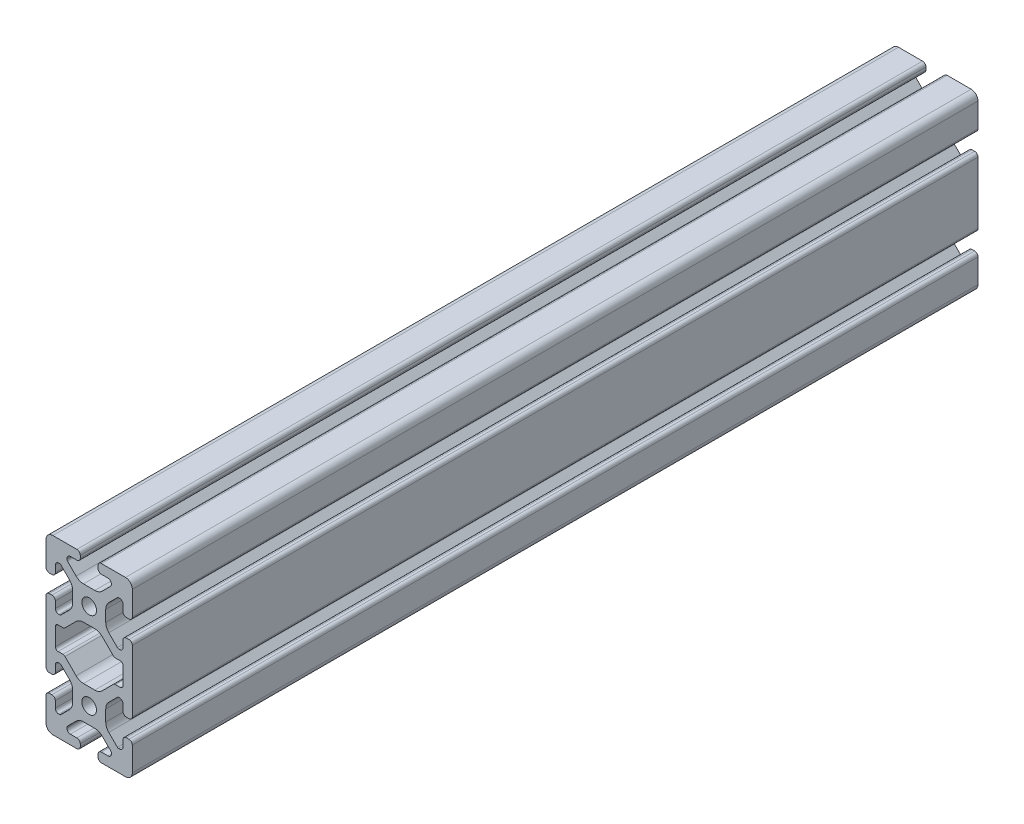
SolidWorks part; units mm, degrees
ref_plane "Front Plane" through (0, 0, 0) normal (0, 0, 1) x (1, 0, 0)
ref_plane "Top Plane" through (0, 0, 0) normal (0, 1, 0) x (1, 0, 0)
ref_plane "Right Plane" through (0, 0, 0) normal (1, 0, 0) x (0, 0, -1)
ref_plane "Plane1" through (0, 0, -3048) normal (0, 0, -1) x (-1, 0, 0)
sketch "Sketch1" plane through (0, 0, -3048) normal (0, 0, -1) x (-1, 0, 0)
  line L0 (14.41, 14.6586) -> (12.13, 14.6586)
  line L1 (11.1794, 14.2308) -> (6.0551, 9.1098)
  line L2 (2.6153, 7.685) -> (-2.6153, 7.685)
  line L3 (-6.0551, 9.1098) -> (-11.232, 14.2867)
  line L4 (-12.13, 14.6586) -> (-14.41, 14.6586)
  line L5 (-15.68, 15.9286) -> (-15.68, 24.0714)
  line L6 (-14.41, 25.3414) -> (-12.13, 25.3414)
  line L7 (-11.232, 25.7133) -> (-6.0551, 30.8902)
  line L8 (-2.6153, 32.315) -> (2.6176, 32.315)
  line L9 (6.0573, 30.8902) -> (11.1842, 25.7634)
  line L10 (12.13, 25.3414) -> (14.41, 25.3414)
  line L11 (15.68, 24.0714) -> (15.68, 15.9286)
  line L12 (16.83, 60) -> (5.6904, 60)
  line L13 (4.1204, 58.43) -> (4.1204, 57.25)
  line L14 (5.6904, 55.68) -> (8.7154, 55.68)
  line L15 (10.2854, 54.11) -> (10.2854, 53.6549)
  line L16 (10.0628, 53.1175) -> (6.0551, 49.1098)
  line L17 (2.6153, 47.685) -> (-2.6153, 47.685)
  line L18 (-6.0551, 49.1098) -> (-10.0628, 53.1175)
  line L19 (-10.2854, 53.6549) -> (-10.2854, 54.11)
  line L20 (-8.7154, 55.68) -> (-5.6904, 55.68)
  line L21 (-4.1204, 57.25) -> (-4.1204, 58.43)
  line L22 (-5.6904, 60) -> (-16.83, 60)
  line L23 (-20, 56.83) -> (-20, 45.6904)
  line L24 (-18.43, 44.1204) -> (-17.25, 44.1204)
  line L25 (-15.68, 45.6904) -> (-15.68, 48.7154)
  line L26 (-14.11, 50.2854) -> (-13.6527, 50.2854)
  line L27 (-13.1153, 50.0628) -> (-9.1098, 46.0573)
  line L28 (-7.685, 42.6176) -> (-7.685, 37.3847)
  line L29 (-9.1098, 33.9449) -> (-13.1175, 29.9372)
  line L30 (-13.6549, 29.7146) -> (-14.11, 29.7146)
  line L31 (-15.68, 31.2846) -> (-15.68, 34.3096)
  line L32 (-17.25, 35.8796) -> (-18.43, 35.8796)
  line L33 (-20, 34.3096) -> (-20, 5.6904)
  line L34 (-18.43, 4.1204) -> (-17.25, 4.1204)
  line L35 (-15.68, 5.6904) -> (-15.68, 8.7154)
  line L36 (-14.11, 10.2854) -> (-13.6549, 10.2854)
  line L37 (-13.1175, 10.0628) -> (-9.1098, 6.0551)
  line L38 (-7.685, 2.6153) -> (-7.685, -2.6153)
  line L39 (-9.1098, -6.0551) -> (-13.1175, -10.0628)
  line L40 (-13.6549, -10.2854) -> (-14.11, -10.2854)
  line L41 (-15.68, -8.7154) -> (-15.68, -5.6904)
  line L42 (-17.25, -4.1204) -> (-18.43, -4.1204)
  line L43 (-20, -5.6904) -> (-20, -16.83)
  line L44 (-16.83, -20) -> (-5.6904, -20)
  line L45 (-4.1204, -18.43) -> (-4.1204, -17.25)
  line L46 (-5.6904, -15.68) -> (-8.7154, -15.68)
  line L47 (-10.2854, -14.11) -> (-10.2854, -13.6549)
  line L48 (-10.0628, -13.1175) -> (-6.0551, -9.1098)
  line L49 (-2.6153, -7.685) -> (2.6153, -7.685)
  line L50 (6.0551, -9.1098) -> (10.0628, -13.1175)
  line L51 (10.2854, -13.6549) -> (10.2854, -14.11)
  line L52 (8.7154, -15.68) -> (5.6904, -15.68)
  line L53 (4.1204, -17.25) -> (4.1204, -18.43)
  line L54 (5.6904, -20) -> (16.83, -20)
  line L55 (20, -16.83) -> (20, -5.6904)
  line L56 (18.43, -4.1204) -> (17.25, -4.1204)
  line L57 (15.68, -5.6904) -> (15.68, -8.7154)
  line L58 (14.11, -10.2854) -> (13.6549, -10.2854)
  line L59 (13.1175, -10.0628) -> (9.1098, -6.0551)
  line L60 (7.685, -2.6153) -> (7.685, 2.6153)
  line L61 (9.1098, 6.0551) -> (13.1175, 10.0628)
  line L62 (13.6549, 10.2854) -> (14.11, 10.2854)
  line L63 (15.68, 8.7154) -> (15.68, 5.6904)
  line L64 (17.25, 4.1204) -> (18.43, 4.1204)
  line L65 (20, 5.6904) -> (20, 34.3096)
  line L66 (18.43, 35.8796) -> (17.25, 35.8796)
  line L67 (15.68, 34.3096) -> (15.68, 31.2846)
  line L68 (14.11, 29.7146) -> (13.6549, 29.7146)
  line L69 (13.1175, 29.9372) -> (9.1098, 33.9449)
  line L70 (7.685, 37.3847) -> (7.685, 42.6153)
  line L71 (9.1098, 46.0551) -> (13.1175, 50.0628)
  line L72 (13.6549, 50.2854) -> (14.11, 50.2854)
  line L73 (15.68, 48.7154) -> (15.68, 45.6904)
  line L74 (17.25, 44.1204) -> (18.43, 44.1204)
  line L75 (20, 45.6904) -> (20, 56.83)
  arc A0 (15.68, 15.9286) -> (14.41, 14.6586) centre (14.41, 15.9286) cw
  arc A1 (12.13, 14.6586) -> (11.1794, 14.2308) centre (12.13, 13.3886) ccw
  arc A2 (6.0551, 9.1098) -> (2.6153, 7.685) centre (2.6153, 12.5496) cw
  arc A3 (-2.6153, 7.685) -> (-6.0551, 9.1098) centre (-2.6153, 12.5496) cw
  arc A4 (-11.232, 14.2867) -> (-12.13, 14.6586) centre (-12.13, 13.3886) ccw
  arc A5 (-14.41, 14.6586) -> (-15.68, 15.9286) centre (-14.41, 15.9286) cw
  arc A6 (-15.68, 24.0714) -> (-14.41, 25.3414) centre (-14.41, 24.0714) cw
  arc A7 (-12.13, 25.3414) -> (-11.232, 25.7133) centre (-12.13, 26.6114) ccw
  arc A8 (-6.0551, 30.8902) -> (-2.6153, 32.315) centre (-2.6153, 27.4504) cw
  arc A9 (2.6176, 32.315) -> (6.0573, 30.8902) centre (2.6176, 27.4504) cw
  arc A10 (11.1842, 25.7634) -> (12.13, 25.3414) centre (12.13, 26.6123) ccw
  arc A11 (14.41, 25.3414) -> (15.68, 24.0714) centre (14.41, 24.0714) cw
  circle A12 centre (0, 0) radius 3.405
  circle A13 centre (0, 40) radius 3.405
  arc A14 (5.6904, 60) -> (4.1204, 58.43) centre (5.6904, 58.43) ccw
  arc A15 (4.1204, 57.25) -> (5.6904, 55.68) centre (5.6904, 57.25) ccw
  arc A16 (8.7154, 55.68) -> (10.2854, 54.11) centre (8.7154, 54.11) cw
  arc A17 (10.2854, 53.6549) -> (10.0628, 53.1175) centre (9.5254, 53.6549) cw
  arc A18 (6.0551, 49.1098) -> (2.6153, 47.685) centre (2.6153, 52.5496) cw
  arc A19 (-2.6153, 47.685) -> (-6.0551, 49.1098) centre (-2.6153, 52.5496) cw
  arc A20 (-10.0628, 53.1175) -> (-10.2854, 53.6549) centre (-9.5254, 53.6549) cw
  arc A21 (-10.2854, 54.11) -> (-8.7154, 55.68) centre (-8.7154, 54.11) cw
  arc A22 (-5.6904, 55.68) -> (-4.1204, 57.25) centre (-5.6904, 57.25) ccw
  arc A23 (-4.1204, 58.43) -> (-5.6904, 60) centre (-5.6904, 58.43) ccw
  arc A24 (-16.83, 60) -> (-20, 56.83) centre (-16.83, 56.83) ccw
  arc A25 (-20, 45.6904) -> (-18.43, 44.1204) centre (-18.43, 45.6904) ccw
  arc A26 (-17.25, 44.1204) -> (-15.68, 45.6904) centre (-17.25, 45.6904) ccw
  arc A27 (-15.68, 48.7154) -> (-14.11, 50.2854) centre (-14.11, 48.7154) cw
  arc A28 (-13.6527, 50.2854) -> (-13.1153, 50.0628) centre (-13.6527, 49.5254) cw
  arc A29 (-9.1098, 46.0573) -> (-7.685, 42.6176) centre (-12.5496, 42.6176) cw
  arc A30 (-7.685, 37.3847) -> (-9.1098, 33.9449) centre (-12.5496, 37.3847) cw
  arc A31 (-13.1175, 29.9372) -> (-13.6549, 29.7146) centre (-13.6549, 30.4746) cw
  arc A32 (-14.11, 29.7146) -> (-15.68, 31.2846) centre (-14.11, 31.2846) cw
  arc A33 (-15.68, 34.3096) -> (-17.25, 35.8796) centre (-17.25, 34.3096) ccw
  arc A34 (-18.43, 35.8796) -> (-20, 34.3096) centre (-18.43, 34.3096) ccw
  arc A35 (-20, 5.6904) -> (-18.43, 4.1204) centre (-18.43, 5.6904) ccw
  arc A36 (-17.25, 4.1204) -> (-15.68, 5.6904) centre (-17.25, 5.6904) ccw
  arc A37 (-15.68, 8.7154) -> (-14.11, 10.2854) centre (-14.11, 8.7154) cw
  arc A38 (-13.6549, 10.2854) -> (-13.1175, 10.0628) centre (-13.6549, 9.5254) cw
  arc A39 (-9.1098, 6.0551) -> (-7.685, 2.6153) centre (-12.5496, 2.6153) cw
  arc A40 (-7.685, -2.6153) -> (-9.1098, -6.0551) centre (-12.5496, -2.6153) cw
  arc A41 (-13.1175, -10.0628) -> (-13.6549, -10.2854) centre (-13.6549, -9.5254) cw
  arc A42 (-14.11, -10.2854) -> (-15.68, -8.7154) centre (-14.11, -8.7154) cw
  arc A43 (-15.68, -5.6904) -> (-17.25, -4.1204) centre (-17.25, -5.6904) ccw
  arc A44 (-18.43, -4.1204) -> (-20, -5.6904) centre (-18.43, -5.6904) ccw
  arc A45 (-20, -16.83) -> (-16.83, -20) centre (-16.83, -16.83) ccw
  arc A46 (-5.6904, -20) -> (-4.1204, -18.43) centre (-5.6904, -18.43) ccw
  arc A47 (-4.1204, -17.25) -> (-5.6904, -15.68) centre (-5.6904, -17.25) ccw
  arc A48 (-8.7154, -15.68) -> (-10.2854, -14.11) centre (-8.7154, -14.11) cw
  arc A49 (-10.2854, -13.6549) -> (-10.0628, -13.1175) centre (-9.5254, -13.6549) cw
  arc A50 (-6.0551, -9.1098) -> (-2.6153, -7.685) centre (-2.6153, -12.5496) cw
  arc A51 (2.6153, -7.685) -> (6.0551, -9.1098) centre (2.6153, -12.5496) cw
  arc A52 (10.0628, -13.1175) -> (10.2854, -13.6549) centre (9.5254, -13.6549) cw
  arc A53 (10.2854, -14.11) -> (8.7154, -15.68) centre (8.7154, -14.11) cw
  arc A54 (5.6904, -15.68) -> (4.1204, -17.25) centre (5.6904, -17.25) ccw
  arc A55 (4.1204, -18.43) -> (5.6904, -20) centre (5.6904, -18.43) ccw
  arc A56 (16.83, -20) -> (20, -16.83) centre (16.83, -16.83) ccw
  arc A57 (20, -5.6904) -> (18.43, -4.1204) centre (18.43, -5.6904) ccw
  arc A58 (17.25, -4.1204) -> (15.68, -5.6904) centre (17.25, -5.6904) ccw
  arc A59 (15.68, -8.7154) -> (14.11, -10.2854) centre (14.11, -8.7154) cw
  arc A60 (13.6549, -10.2854) -> (13.1175, -10.0628) centre (13.6549, -9.5254) cw
  arc A61 (9.1098, -6.0551) -> (7.685, -2.6153) centre (12.5496, -2.6153) cw
  arc A62 (7.685, 2.6153) -> (9.1098, 6.0551) centre (12.5496, 2.6153) cw
  arc A63 (13.1175, 10.0628) -> (13.6549, 10.2854) centre (13.6549, 9.5254) cw
  arc A64 (14.11, 10.2854) -> (15.68, 8.7154) centre (14.11, 8.7154) cw
  arc A65 (15.68, 5.6904) -> (17.25, 4.1204) centre (17.25, 5.6904) ccw
  arc A66 (18.43, 4.1204) -> (20, 5.6904) centre (18.43, 5.6904) ccw
  arc A67 (20, 34.3096) -> (18.43, 35.8796) centre (18.43, 34.3096) ccw
  arc A68 (17.25, 35.8796) -> (15.68, 34.3096) centre (17.25, 34.3096) ccw
  arc A69 (15.68, 31.2846) -> (14.11, 29.7146) centre (14.11, 31.2846) cw
  arc A70 (13.6549, 29.7146) -> (13.1175, 29.9372) centre (13.6549, 30.4746) cw
  arc A71 (9.1098, 33.9449) -> (7.685, 37.3847) centre (12.5496, 37.3847) cw
  arc A72 (7.685, 42.6153) -> (9.1098, 46.0551) centre (12.5496, 42.6153) cw
  arc A73 (13.1175, 50.0628) -> (13.6549, 50.2854) centre (13.6549, 49.5254) cw
  arc A74 (14.11, 50.2854) -> (15.68, 48.7154) centre (14.11, 48.7154) cw
  arc A75 (15.68, 45.6904) -> (17.25, 44.1204) centre (17.25, 45.6904) ccw
  arc A76 (18.43, 44.1204) -> (20, 45.6904) centre (18.43, 45.6904) ccw
  arc A77 (20, 56.83) -> (16.83, 60) centre (16.83, 56.83) ccw
extrude "Boss-Extrude1" add sketch "Sketch1" against normal blind 3048
ref_plane "2.5 ft cut1" through (0, 0, -762) normal (0, 0, 1) x (1, 0, 0)
ref_plane "2.5 ft cut2" through (0, 0, -1524) normal (0, 0, 1) x (1, 0, 0)
ref_plane "16.14 in cut3" through (0, 0, -1933.956) normal (0, 0, 1) x (1, 0, 0)
ref_plane "13 in cut4" through (0, 0, -2264.156) normal (0, 0, 1) x (1, 0, 0)
ref_plane "midplane cut5" through (0, 0, -2656.078) normal (0, 0, 1) x (1, 0, 0)
sketch "Sketch26" plane through (0, 0, -762) normal (0, 0, 1) x (1, 0, 0)
  line L0 (-20, -20.8001) -> (20, -20.8001)
  line L1 (-20, -20.8001) -> (-20, 60)
  line L2 (-20, 60) -> (20, 60)
  line L3 (20, -20.8001) -> (20, 60)
sketch "Sketch33" plane through (0, 0, -1524) normal (0, 0, 1) x (1, 0, 0)
  line L5 (-20, 60) -> (20, 60)
  line L6 (-20, 60) -> (-20, -20.8001)
  line L7 (-20, -20.8001) -> (20, -20.8001)
  line L8 (20, 60) -> (20, -20.8001)
sketch "Sketch41" plane through (0, 0, -1933.956) normal (0, 0, 1) x (1, 0, 0)
  line L0 (-20, -20.8001) -> (20, -20.8001)
  line L1 (-20, -20.8001) -> (-20, 60)
  line L2 (-20, 60) -> (20, 60)
  line L3 (20, -20.8001) -> (20, 60)
sketch "Sketch50" plane through (0, 0, -2264.156) normal (0, 0, 1) x (1, 0, 0)
  line L0 (-20, -20.8001) -> (20, -20.8001)
  line L1 (-20, -20.8001) -> (-20, 60)
  line L2 (-20, 60) -> (20, 60)
  line L3 (20, -20.8001) -> (20, 60)
sketch "Sketch51" plane through (0, 0, -2656.078) normal (0, 0, 1) x (1, 0, 0)
  line L1 (-20, 60) -> (20, 60)
  line L2 (-20, 60) -> (-20, -20.8001)
  line L3 (-20, -20.8001) -> (20, -20.8001)
  line L4 (20, 60) -> (20, -20.8001)
extrude "Cut-Extrude1" cut sketch "Sketch26" along normal through all
extrude "Cut-Extrude2" cut sketch "Sketch33" along normal through all
extrude "Cut-Extrude3" cut sketch "Sketch41" along normal through all
extrude "Cut-Extrude4" cut sketch "Sketch50" along normal through all
extrude "Cut-Extrude5" cut sketch "Sketch51" against normal through all
